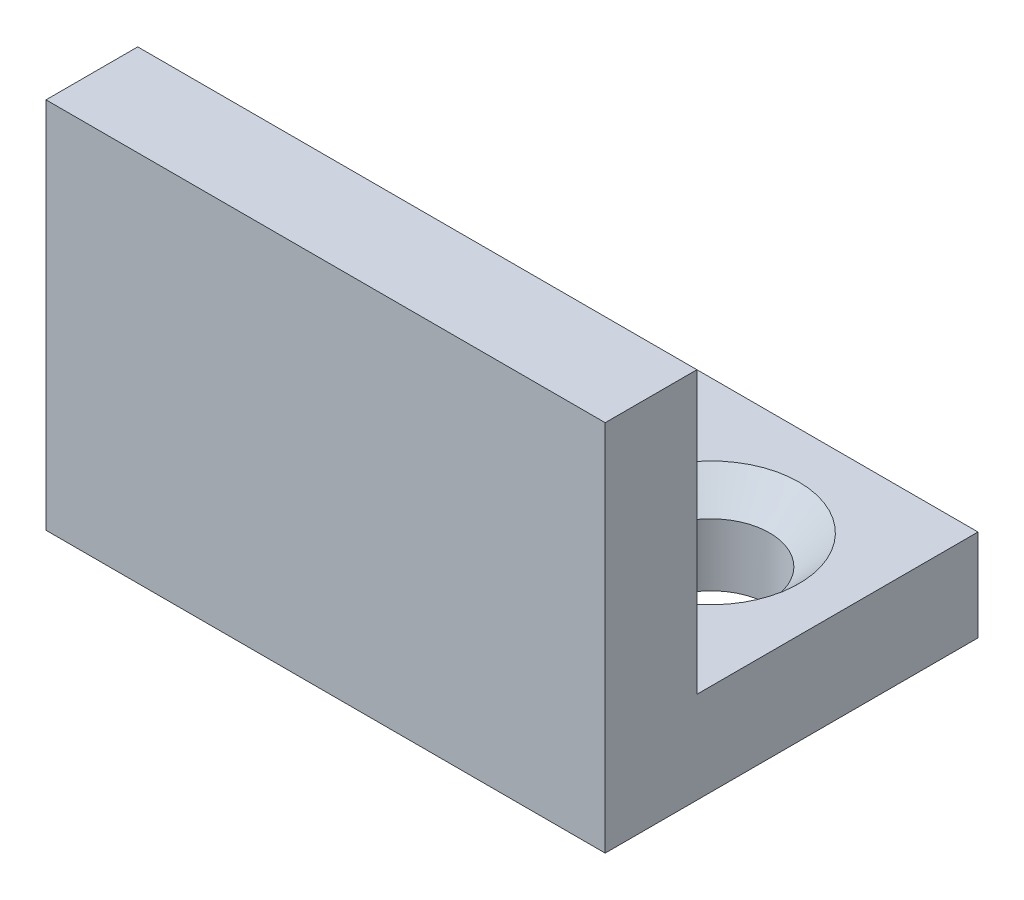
SolidWorks part; units mm, degrees
ref_plane "Front Plane" through (0, 0, 0) normal (0, 0, 1) x (1, 0, 0)
ref_plane "Top Plane" through (0, 0, 0) normal (0, 1, 0) x (1, 0, 0)
ref_plane "Right Plane" through (0, 0, 0) normal (1, 0, 0) x (0, 0, -1)
sketch "Sketch1" plane through (0, 0, 0) normal (1, 0, 0) x (0, 0, -1)
  line L0 (0, 9.575) -> (0, 0)
  line L1 (0, 0) -> (9.575, 0)
  line L2 (9.575, 0) -> (9.575, -3.125)
  line L3 (9.575, -3.125) -> (-3.125, -3.125)
  line L4 (-3.125, -3.125) -> (-3.125, 9.575)
  line L5 (-3.125, 9.575) -> (0, 9.575)
  dimension "D1" = 3.125
  dimension "D2" = 3.125
  dimension "D3" = 12.7
  dimension "D4" = 12.7
extrude "Boss-Extrude1" add sketch "Sketch1" along normal mid plane 19.05 contours L2 L3 L4 L5 L0 L1
sketch "Sketch2" plane through (0, 0, 0) normal (0, 1, 0) x (1, 0, 0)
  line L0 (0, 0) -> (0, 7.7677) construction
  line L1 (9.525, 0) -> (-9.525, 0) construction
  circle A0 centre (-5, 5) radius 2
  circle A1 centre (5, 5) radius 2
  dimension "D1" = 4
  dimension "D2" = 5
  dimension "D3" = 10
extrude "Cut-Extrude1" cut sketch "Sketch2" against normal up to next
chamfer "Chamfer1" distance 1 angle 45 2 edges at (5, 0, -3) (-5, 0, -3)
